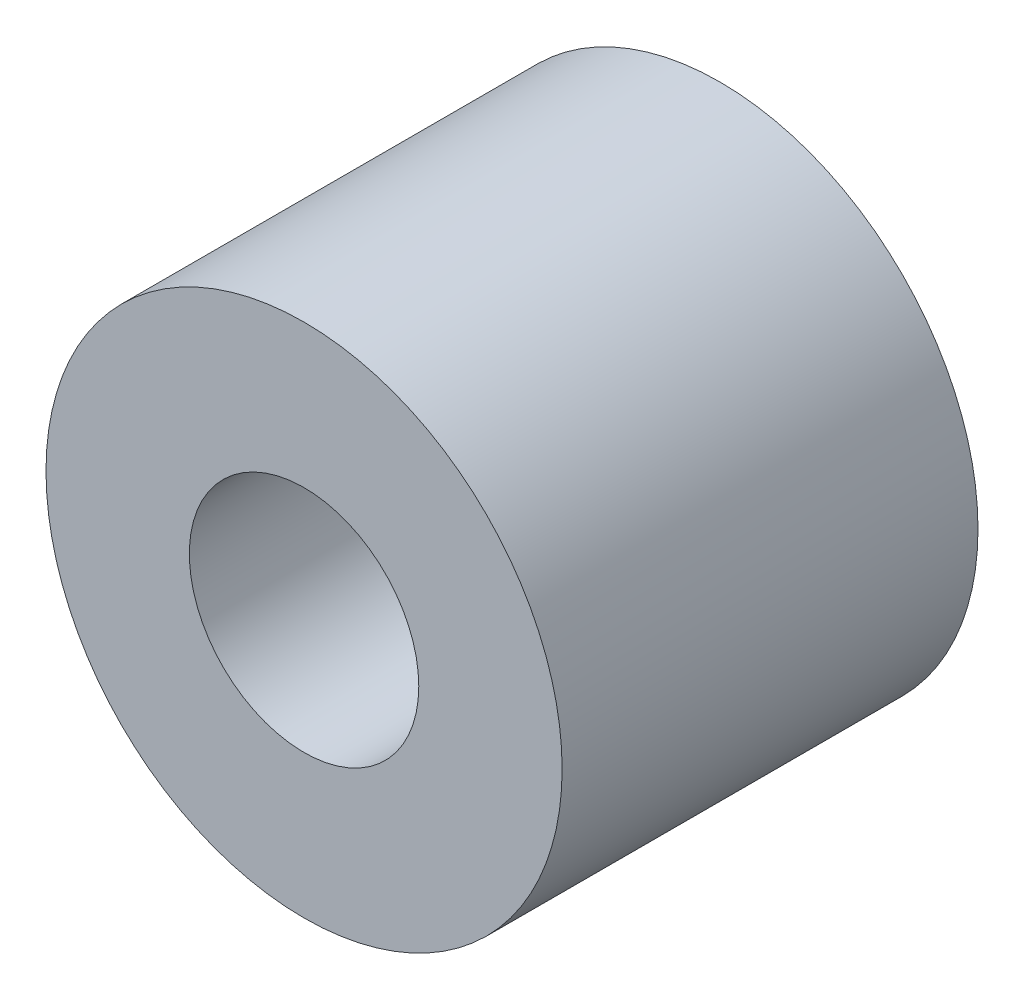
SolidWorks part; units mm, degrees
ref_plane "Plan de face" through (0, 0, 0) normal (0, 0, 1) x (1, 0, 0)
ref_plane "Plan de dessus" through (0, 0, 0) normal (0, 1, 0) x (1, 0, 0)
ref_plane "Plan de droite" through (0, 0, 0) normal (1, 0, 0) x (0, 0, -1)
sketch "Esquisse1" plane through (0, 0, 0) normal (0, 0, 1) x (1, 0, 0)
  circle A0 centre (0, 0) radius 4 construction
  circle A1 centre (0, 0) radius 4
  circle A2 centre (0, 0) radius 8.9978 construction
  circle A3 centre (0, 0) radius 8.9978
extrude "Extrusion1" add sketch "Esquisse1" along normal up to surface (14.5 mm away)
